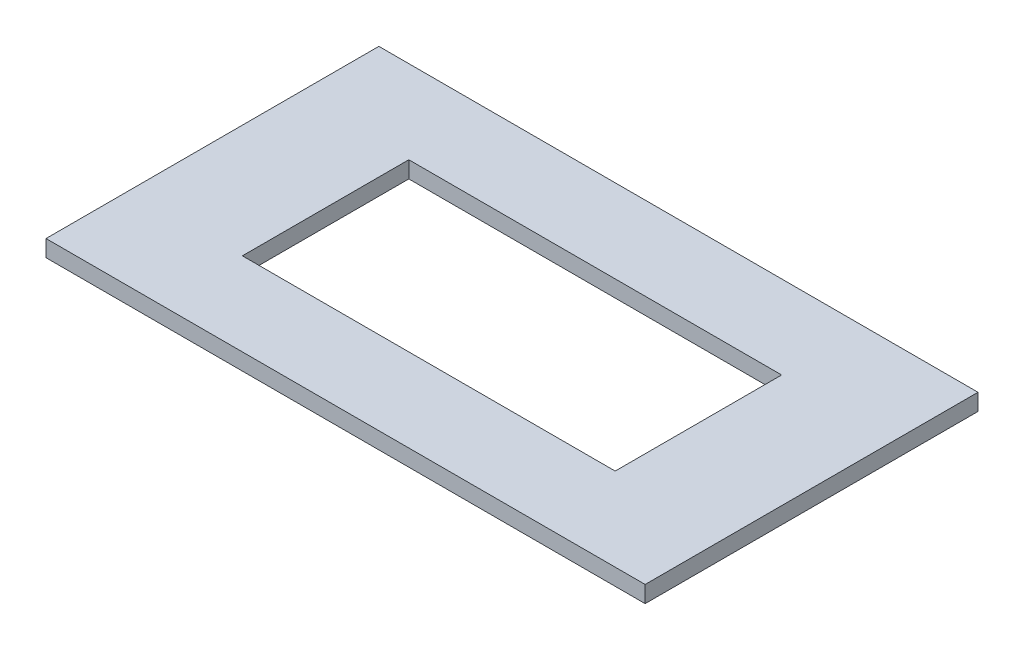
SolidWorks part; units mm, degrees
ref_plane "Front Plane" through (0, 0, 0) normal (0, 0, 1) x (1, 0, 0)
ref_plane "Top Plane" through (0, 0, 0) normal (0, 1, 0) x (1, 0, 0)
ref_plane "Right Plane" through (0, 0, 0) normal (1, 0, 0) x (0, 0, -1)
sketch "Sketch1" plane through (0, 0, 0) normal (0, 1, 0) x (1, 0, 0)
  line L1 (-45, 25) -> (45, 25)
  line L2 (-45, 25) -> (-45, -25)
  line L3 (-45, -25) -> (45, -25)
  line L4 (45, 25) -> (45, -25)
  line L5 (-45, 25) -> (45, -25) construction
  line L6 (-45, -25) -> (45, 25) construction
  line L7 (28, -12.5) -> (-28, -12.5)
  line L8 (28, -12.5) -> (28, 12.5)
  line L9 (28, 12.5) -> (-28, 12.5)
  line L10 (-28, -12.5) -> (-28, 12.5)
  line L11 (28, -12.5) -> (-28, 12.5) construction
  line L12 (28, 12.5) -> (-28, -12.5) construction
  point P0 (0, 0)
  point P6 (0, 0)
  dimension "D1" = 90
  dimension "D2" = 50
  dimension "D3" = 25
  dimension "D4" = 28
  dimension "D5" = 28
extrude "Boss-Extrude1" add sketch "Sketch1" along normal blind 2.5
